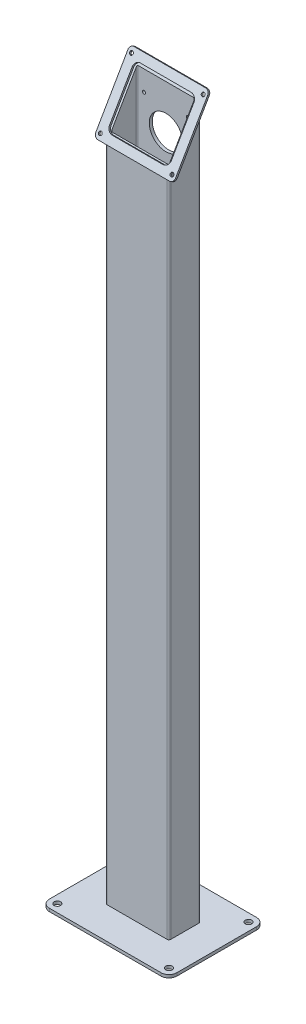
SolidWorks part; units mm, degrees
ref_plane "Front" through (0, 0, 0) normal (0, 0, 1) x (1, 0, 0)
ref_plane "Top" through (0, 0, 0) normal (0, 1, 0) x (1, 0, 0)
ref_plane "Right" through (0, 0, 0) normal (1, 0, 0) x (0, 0, -1)
sketch "Sketch1" plane through (0, 0, 0) normal (0, 1, 0) x (1, 0, 0)
  line L1 (-88.9, 76.2) -> (88.9, 76.2)
  line L2 (-101.6, 63.5) -> (-101.6, -63.5)
  line L3 (-88.9, -76.2) -> (88.9, -76.2)
  line L4 (101.6, 63.5) -> (101.6, -63.5)
  line L5 (-101.6, 76.2) -> (101.6, -76.2) construction
  line L6 (-101.6, -76.2) -> (101.6, 76.2) construction
  arc A0 (88.9, -76.2) -> (101.6, -63.5) centre (88.9, -63.5) ccw
  arc A1 (-101.6, -63.5) -> (-88.9, -76.2) centre (-88.9, -63.5) ccw
  arc A2 (88.9, 76.2) -> (101.6, 63.5) centre (88.9, 63.5) cw
  arc A3 (-88.9, 76.2) -> (-101.6, 63.5) centre (-88.9, 63.5) ccw
  point P0 (0, 0)
  dimension "D3" = 12.7
  dimension "D1" = 203.2
  dimension "D2" = 152.4
extrude "Boss-Extrude1" add sketch "Sketch1" along normal blind 4.7752
sketch "Sketch2" plane through (0, 0, 0) normal (0, 1, 0) x (1, 0, 0)
  line L1 (88.9, 63.5) -> (-88.9, 63.5) construction
  line L2 (88.9, 63.5) -> (88.9, -63.5) construction
  line L3 (88.9, -63.5) -> (-88.9, -63.5) construction
  line L4 (-88.9, 63.5) -> (-88.9, -63.5) construction
  line L5 (88.9, 63.5) -> (-88.9, -63.5) construction
  line L6 (88.9, -63.5) -> (-88.9, 63.5) construction
  circle A0 centre (88.9, 63.5) radius 5.2
  circle A1 centre (88.9, -63.5) radius 5.2
  circle A2 centre (-88.9, -63.5) radius 5.2
  circle A3 centre (-88.9, 63.5) radius 5.2
  point P0 (0, 0)
  dimension "D3" = 10.4
  dimension "D1" = 177.8
  dimension "D2" = 127
extrude "Cut-Extrude2" cut sketch "Sketch2" along normal through all
sketch "Sketch3" plane through (0, 0, 0) normal (0, 1, 0) x (1, 0, 0)
  line L1 (-50.8, 25.4) -> (50.8, 25.4)
  line L2 (-50.8, 25.4) -> (-50.8, -25.4)
  line L3 (-50.8, -25.4) -> (50.8, -25.4)
  line L4 (50.8, 25.4) -> (50.8, -25.4)
  line L5 (-50.8, 25.4) -> (50.8, -25.4) construction
  line L6 (-50.8, -25.4) -> (50.8, 25.4) construction
  point P0 (0, 0)
  dimension "D1" = 101.6
  dimension "D2" = 50.8
extrude "Boss-Extrude2" add sketch "Sketch3" along normal blind 1206.5
sketch "Sketch4" plane through (0, 0, 0) normal (1, 0, 0) x (0, 0, -1)
  line L0 (25.4, 1150.1907) -> (-25.4, 1062.2026)
  line L1 (-25.4, 1062.2026) -> (-25.4, 1206.5)
  line L2 (-25.4, 1206.5) -> (25.4, 1206.5)
  line L3 (25.4, 1206.5) -> (25.4, 1150.1907)
  line L4 (25.4, 1206.5) -> (-25.4, 1206.5) construction
  line L5 (25.4, 1206.5) -> (25.4, 4.7752) construction
  line L6 (-25.4, 1206.5) -> (-25.4, 4.7752) construction
  dimension "D1" = 30
  dimension "D2" = 56.3093
extrude "Cut-Extrude3" cut sketch "Sketch4" against normal through all both and the other way through all
ref_plane "Plane1" through (0, 282.0597, 488.5417) normal (0, 0.5, 0.866) x (1, 0, 0)
ref_plane "Plane2" through (0, 0, -5.5067) normal (0, 0, -1) x (-1, 0, 0)
fillet "Fillet1" radius 3 4 edges at (-50.8, 577.483, -25.4) (50.8, 577.483, -25.4) (50.8, 533.4889, 25.4) (-50.8, 533.4889, 25.4)
sketch "Sketch5" plane through (0, 0, 0) normal (0, -1, 0) x (1, 0, 0)
  line L8 (-46.0248, 20.6248) -> (-46.0248, -20.6248)
  line L9 (-46.0248, -20.6248) -> (46.0248, -20.6248)
  line L10 (46.0248, -20.6248) -> (46.0248, 20.6248)
  line L11 (46.0248, 20.6248) -> (-46.0248, 20.6248)
  line L12 (-46.0248, 20.6248) -> (-46.0248, -20.6248)
  line L13 (-46.0248, -20.6248) -> (46.0248, -20.6248)
  line L14 (46.0248, -20.6248) -> (46.0248, 20.6248)
  line L15 (46.0248, 20.6248) -> (-46.0248, 20.6248)
  dimension "D1" = 4.7752
extrude "Cut-Extrude4" cut sketch "Sketch5" against normal through all
fillet "Fillet2" radius 1.5 4 edges at (-46.0248, 570.9599, -20.6248) (-46.0248, 535.2367, 20.6248) (46.0248, 535.2367, 20.6248) (46.0248, 570.9599, -20.6248)
sketch "Sketch6" plane through (0, 276.5492, 478.9972) normal (0, 0.5, 0.866) x (1, 0, 0)
  line L0 (0, -83.82) -> (0, 83.82) construction
  line L1 (-57.15, 1016.8335) -> (57.15, 1016.8335)
  line L2 (-63.5, 1010.4835) -> (-63.5, 907.8294)
  line L3 (-57.15, 901.4794) -> (57.15, 901.4794)
  line L4 (63.5, 1010.4835) -> (63.5, 907.8294)
  line L5 (-63.5, 1016.8335) -> (63.5, 901.4794) construction
  line L6 (-63.5, 901.4794) -> (63.5, 1016.8335) construction
  line L7 (-47.8, 1008.7944) -> (47.8, 1008.7944) construction
  line L9 (-40.3225, 1003.8562) -> (40.3225, 1003.8562)
  line L10 (-49.2125, 994.9662) -> (-49.2125, 923.3467)
  line L11 (-40.3225, 914.4567) -> (40.3225, 914.4567)
  line L12 (49.2125, 994.9662) -> (49.2125, 923.3467)
  arc A0 (-49.2125, 923.3467) -> (-40.3225, 914.4567) centre (-40.3225, 923.3467) ccw
  arc A1 (40.3225, 914.4567) -> (49.2125, 923.3467) centre (40.3225, 923.3467) ccw
  arc A2 (40.3225, 1003.8562) -> (49.2125, 994.9662) centre (40.3225, 994.9662) cw
  arc A3 (-40.3225, 1003.8562) -> (-49.2125, 994.9662) centre (-40.3225, 994.9662) ccw
  arc A4 (-63.5, 907.8294) -> (-57.15, 901.4794) centre (-57.15, 907.8294) ccw
  arc A5 (57.15, 901.4794) -> (63.5, 907.8294) centre (57.15, 907.8294) ccw
  arc A6 (57.15, 1016.8335) -> (63.5, 1010.4835) centre (57.15, 1010.4835) cw
  arc A7 (-57.15, 1016.8335) -> (-63.5, 1010.4835) centre (-57.15, 1010.4835) ccw
  point P0 (0, 959.1565)
  point P13 (0, 1003.8562)
  point P14 (0, 1016.8335)
  point P15 (-49.2125, 959.1565)
  point P16 (-63.5, 959.1565)
  point P19 (-49.2125, 914.4567)
  point P22 (49.2125, 914.4567)
  point P25 (49.2125, 1003.8562)
  point P28 (-49.2125, 1003.8562)
  dimension "D6" = 8.89
  dimension "D7" = 6.35
  dimension "D1" = 127
  dimension "D2" = 115.3541
  dimension "D3" = 8.0391
  dimension "D4" = 89.3994
  dimension "D5" = 98.425
extrude "Boss-Extrude3" add sketch "Sketch6" along normal blind 3
hole_wizard "7/32 (0.21875) Diameter Hole1" positions "Sketch7" profile "Sketch8" hole size "7/32" standard "ANSI Inch"
sketch "Sketch7" plane through (0, 278.0492, 481.5953) normal (0, 0.5, 0.866) x (1, 0, 0)
  line L0 (57.15, 1008.8135) -> (-57.15, 1008.8135) construction
  line L1 (-57.15, 1008.8135) -> (-57.15, 909.4995) construction
  line L3 (57.15, 1016.8335) -> (-57.15, 1016.8335) construction
  line L4 (-63.5, 1010.4835) -> (-63.5, 907.8294) construction
  point P0 (-57.15, 1008.8135)
  point P2 (57.15, 1008.8135)
  point P4 (57.15, 909.4995)
  point P6 (-57.15, 909.4995)
  point P19 (0, 1008.8135)
  point P22 (0, 1016.8335)
  point P23 (-57.15, 959.1565)
  point P26 (-63.5, 959.1565)
  dimension "D1" = 114.3
  dimension "D2" = 99.314
sketch "Sketch8" plane through (-57.15, 1151.7072, -22.8114) normal (1, 0, 0) x (0, -0.866, 0.5)
  line L0 (0, 0) -> (0, 3)
  line L1 (0, 3) -> (2.7781, 3)
  line L2 (2.7781, 3) -> (2.7781, 0)
  line L5 (2.7781, 0) -> (0, 0)
  line L11 (0, -6.35) -> (0, 107.95) construction
  dimension "Thru Hole Dia." = 5.5562
  dimension "Thru Hole Depth" = 3
hole_wizard "Tap Drill for 1/4-20 Tap1" positions "Sketch9" profile "Sketch10" hole size "1/4-20" standard "ANSI Inch"
sketch "Sketch9" plane through (0, 0, -25.4) normal (0, 0, -1) x (-1, 0, 0)
  line L0 (-34.925, 1109.6752) -> (34.925, 1109.6752) construction
  line L2 (47.8, 1150.1907) -> (-47.8, 1150.1907) construction
  line L3 (-88.9, 4.7752) -> (88.9, 4.7752) construction
  point P0 (-34.925, 1109.6752)
  point P2 (34.925, 1109.6752)
  point P4 (34.925, 792.1752)
  point P6 (-34.925, 792.1752)
  point P8 (-34.925, 658.8252)
  point P10 (34.925, 658.8252)
  point P12 (34.925, 207.9752)
  point P14 (-34.925, 207.9752)
  point P30 (0, 1109.6752)
  point P33 (0, 1150.1907)
  dimension "D1" = 69.85
  dimension "D2" = 203.2
  dimension "D3" = 450.85
  dimension "D4" = 584.2
  dimension "D5" = 901.7
sketch "Sketch10" plane through (34.925, 1109.6752, -25.4) normal (1, 0, 0) x (0, 1, 0)
  line L0 (0, 0) -> (0, 4.7752)
  line L1 (0, 4.7752) -> (2.5527, 4.7752)
  line L2 (2.5527, 4.7752) -> (2.5527, 0)
  line L5 (2.5527, 0) -> (0, 0)
  line L11 (0, -6.35) -> (0, 107.95) construction
  dimension "Thru Hole Dia." = 5.1054
  dimension "Thru Hole Depth" = 4.7752
sketch "Sketch11" plane through (0, 0, -25.4) normal (0, 0, -1) x (-1, 0, 0)
  line L0 (47.8, 1150.1907) -> (-47.8, 1150.1907) construction
  circle A0 centre (0, 1071.5752) radius 26.543
  circle A1 centre (-34.925, 1109.6752) radius 2.5527 construction
  point P5 (0, 1150.1907)
  dimension "D1" = 53.086
  dimension "D2" = 38.1
extrude "Cut-Extrude5" cut sketch "Sketch11" against normal up to next
